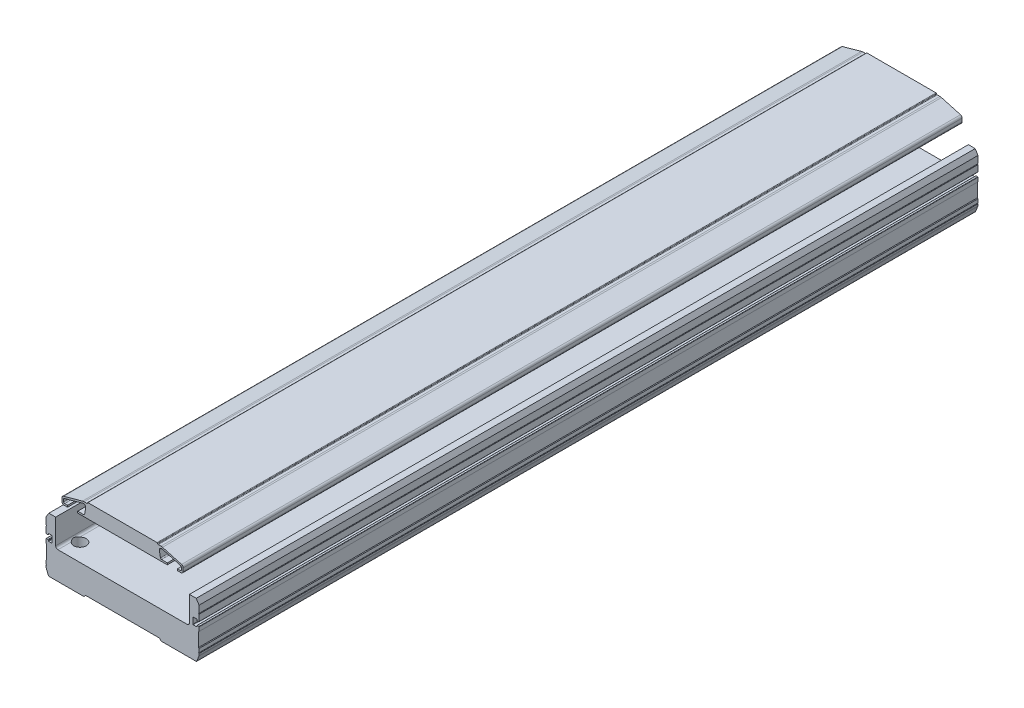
SolidWorks part; units mm, degrees
ref_plane "前视基准面" through (0, 0, 0) normal (0, 0, 1) x (1, 0, 0)
ref_plane "上视基准面" through (0, 0, 0) normal (0, 1, 0) x (1, 0, 0)
ref_plane "右视基准面" through (0, 0, 0) normal (1, 0, 0) x (0, 0, -1)
sketch "草图1" plane through (0, 0, 0) normal (0, 0, 1) x (1, 0, 0)
  line B0 (-39.5, 59.4) -> (39.5, 59.4)
  line B1 (39.5, 59.4) -> (39.5, 60.9)
  line B2 (39.5, 60.9) -> (34.4, 60.9)
  line B3 (33.4138, 61.7343) -> (32.5361, 66.9593)
  line B4 (35.0485, 69.2164) -> (51.27, 64.6675)
  line B5 (52, 63.7046) -> (52, 61.9)
  line B6 (51, 60.9) -> (48.5, 60.9)
  line B7 (48.5, 60.9) -> (48.5, 59.4)
  line B8 (48.5, 59.4) -> (51.5, 59.4)
  line B9 (53.5, 61.4) -> (53.5, 64.0837)
  line B10 (52.04, 66.0094) -> (35.2622, 70.7143)
  line B11 (33.9122, 70.9) -> (31.5, 70.9)
  line B12 (30.5, 71.9) -> (-30.5, 71.9)
  line B13 (-31.5, 70.9) -> (-33.9122, 70.9)
  line B14 (-35.2622, 70.7143) -> (-52.04, 66.0094)
  line B15 (-53.5, 64.0837) -> (-53.5, 61.4)
  line B16 (-51.5, 59.4) -> (-48.5, 59.4)
  line B17 (-48.5, 59.4) -> (-48.5, 60.9)
  line B18 (-48.5, 60.9) -> (-51, 60.9)
  line B19 (-52, 61.9) -> (-52, 63.7046)
  line B20 (-51.27, 64.6675) -> (-35.0485, 69.2164)
  line B21 (-32.5361, 66.9593) -> (-33.4138, 61.7343)
  line B22 (-34.4, 60.9) -> (-39.5, 60.9)
  line B23 (-39.5, 60.9) -> (-39.5, 59.4)
  line B24 (-67, 22) -> (-67, 10)
  line B25 (-67, 10) -> (-67.5, 9.5)
  line B26 (-67.5, 9.5) -> (-67.5, 6.375)
  line B27 (-67.5, 5.625) -> (-67.5, 4.3812)
  line B28 (-67.36, 3.6469) -> (-65.5064, -1.0289)
  line B29 (-65.16, -1.6) -> (-34.1, -1.6)
  line B30 (-34.1, -1.6) -> (-32.5, 0)
  line B31 (-32.5, 0) -> (32.5, 0)
  line B32 (32.5, 0) -> (34.1, -1.6)
  line B33 (34.1, -1.6) -> (65.16, -1.6)
  line B34 (65.5064, -1.0289) -> (67.36, 3.6469)
  line B35 (67.5, 4.3812) -> (67.5, 5.625)
  line B36 (67.5, 6.375) -> (67.5, 9.5)
  line B37 (67.5, 9.5) -> (67, 10)
  line B38 (67, 10) -> (67, 22)
  line B39 (67, 22) -> (67.5, 22.5)
  line B40 (67.5, 22.5) -> (67.5, 25.9)
  line B41 (67.2, 26.2) -> (65.8, 26.2)
  line B42 (65.5, 25.9) -> (65.5, 25.3)
  line B43 (65.2, 25) -> (62.3, 25)
  line B44 (62, 25.3) -> (62, 30.7)
  line B45 (62.3, 31) -> (65.2, 31)
  line B46 (65.5, 30.7) -> (65.5, 30.1)
  line B47 (65.8, 29.8) -> (67.2, 29.8)
  line B48 (67.5, 30.1) -> (67.5, 35.625)
  line B49 (67.5, 36.375) -> (67.5, 42.6)
  line B50 (67.5, 42.6) -> (65, 46.6)
  line B51 (65, 46.6) -> (59, 46.6)
  line B52 (59, 46.6) -> (59, 24.7)
  line B53 (57, 22.7) -> (-57, 22.7)
  line B54 (-59, 24.7) -> (-59, 46.6)
  line B55 (-59, 46.6) -> (-65, 46.6)
  line B56 (-65, 46.6) -> (-67.5, 42.6)
  line B57 (-67.5, 42.6) -> (-67.5, 36.375)
  line B58 (-67.5, 35.625) -> (-67.5, 30.1)
  line B59 (-67.2, 29.8) -> (-65.8, 29.8)
  line B60 (-65.5, 30.1) -> (-65.5, 30.7)
  line B61 (-65.2, 31) -> (-62.3, 31)
  line B62 (-62, 30.7) -> (-62, 25.3)
  line B63 (-62.3, 25) -> (-65.2, 25)
  line B64 (-65.5, 25.3) -> (-65.5, 25.9)
  line B65 (-65.8, 26.2) -> (-67.2, 26.2)
  line B66 (-67.5, 25.9) -> (-67.5, 22.5)
  line B67 (-67.5, 22.5) -> (-67, 22)
  arc B68 (33.4138, 61.7343) -> (34.4, 60.9) centre (34.4, 61.9) ccw
  arc B69 (35.0485, 69.2164) -> (32.5361, 66.9593) centre (34.5085, 67.2906) ccw
  arc B70 (52, 63.7046) -> (51.27, 64.6675) centre (51, 63.7046) ccw
  arc B71 (51, 60.9) -> (52, 61.9) centre (51, 61.9) ccw
  arc B72 (51.5, 59.4) -> (53.5, 61.4) centre (51.5, 61.4) ccw
  arc B73 (53.5, 64.0837) -> (52.04, 66.0094) centre (51.5, 64.0837) ccw
  arc B74 (35.2622, 70.7143) -> (33.9122, 70.9) centre (33.9122, 65.9) ccw
  arc B75 (31, 71.4) -> (31.5, 70.9) centre (31.5, 71.4) ccw
  arc B76 (31, 71.4) -> (30.5, 71.9) centre (30.5, 71.4) ccw
  arc B77 (-30.5, 71.9) -> (-31, 71.4) centre (-30.5, 71.4) ccw
  arc B78 (-31.5, 70.9) -> (-31, 71.4) centre (-31.5, 71.4) ccw
  arc B79 (-33.9122, 70.9) -> (-35.2622, 70.7143) centre (-33.9122, 65.9) ccw
  arc B80 (-52.04, 66.0094) -> (-53.5, 64.0837) centre (-51.5, 64.0837) ccw
  arc B81 (-53.5, 61.4) -> (-51.5, 59.4) centre (-51.5, 61.4) ccw
  arc B82 (-52, 61.9) -> (-51, 60.9) centre (-51, 61.9) ccw
  arc B83 (-51.27, 64.6675) -> (-52, 63.7046) centre (-51, 63.7046) ccw
  arc B84 (-32.5361, 66.9593) -> (-35.0485, 69.2164) centre (-34.5085, 67.2906) ccw
  arc B85 (-34.4, 60.9) -> (-33.4138, 61.7343) centre (-34.4, 61.9) ccw
  arc B86 (-67.5, 5.625) -> (-67.5, 6.375) centre (-67.5, 6) ccw
  arc B87 (-67.5, 4.3812) -> (-67.36, 3.6469) centre (-65.5, 4.382) ccw
  arc B88 (-65.5064, -1.0289) -> (-65.16, -1.6) centre (-63.6472, -0.2918) ccw
  arc B89 (65.16, -1.6) -> (65.5064, -1.0289) centre (63.6472, -0.2918) ccw
  arc B90 (67.36, 3.6469) -> (67.5, 4.3812) centre (65.5, 4.382) ccw
  arc B91 (67.5, 6.375) -> (67.5, 5.625) centre (67.5, 6) ccw
  arc B92 (67.5, 25.9) -> (67.2, 26.2) centre (67.2, 25.9) ccw
  arc B93 (65.8, 26.2) -> (65.5, 25.9) centre (65.8, 25.9) ccw
  arc B94 (65.2, 25) -> (65.5, 25.3) centre (65.2, 25.3) ccw
  arc B95 (62, 25.3) -> (62.3, 25) centre (62.3, 25.3) ccw
  arc B96 (62.3, 31) -> (62, 30.7) centre (62.3, 30.7) ccw
  arc B97 (65.5, 30.7) -> (65.2, 31) centre (65.2, 30.7) ccw
  arc B98 (65.5, 30.1) -> (65.8, 29.8) centre (65.8, 30.1) ccw
  arc B99 (67.2, 29.8) -> (67.5, 30.1) centre (67.2, 30.1) ccw
  arc B100 (67.5, 36.375) -> (67.5, 35.625) centre (67.5, 36) ccw
  arc B101 (57, 22.7) -> (59, 24.7) centre (57, 24.7) ccw
  arc B102 (-59, 24.7) -> (-57, 22.7) centre (-57, 24.7) ccw
  arc B103 (-67.5, 35.625) -> (-67.5, 36.375) centre (-67.5, 36) ccw
  arc B104 (-67.5, 30.1) -> (-67.2, 29.8) centre (-67.2, 30.1) ccw
  arc B105 (-65.8, 29.8) -> (-65.5, 30.1) centre (-65.8, 30.1) ccw
  arc B106 (-65.2, 31) -> (-65.5, 30.7) centre (-65.2, 30.7) ccw
  arc B107 (-62, 30.7) -> (-62.3, 31) centre (-62.3, 30.7) ccw
  arc B108 (-62.3, 25) -> (-62, 25.3) centre (-62.3, 25.3) ccw
  arc B109 (-65.5, 25.3) -> (-65.2, 25) centre (-65.2, 25.3) ccw
  arc B110 (-65.5, 25.9) -> (-65.8, 26.2) centre (-65.8, 25.9) ccw
  arc B111 (-67.2, 26.2) -> (-67.5, 25.9) centre (-67.2, 25.9) ccw
sketch_block_instance "块4-1"
sketch_block "块4"
extrude "凸台-拉伸1" add sketch "草图1" against normal blind 687
hole_wizard "打孔尺寸(%根据)内六角圆柱头螺钉的类型1" positions "草图3" profile "草图4" counterbore size "M6" standard "GB"
sketch "草图3" plane through (0, 46.6, 0) normal (0, 1, 0) x (1, 0, 0)
  line L4 (34.1, 687) -> (65.16, 687) construction
  line L5 (0, 687) -> (0, 1140.2602) construction
  line L6 (-32.5, 687) -> (32.5, 687) construction
  point P0 (-53, 615.5)
  point P2 (53, 615.5)
  point P13 (53, 415.5)
  point P15 (-53, 415.5)
  point P22 (53, 215.5)
  point P24 (-53, 215.5)
  point P25 (53, 15.5)
  point P27 (-53, 15.5)
  point P29 (53, -184.5)
  point P31 (-53, -184.5)
  point P33 (53, -384.5)
  point P35 (-53, -384.5)
  point P45 (-53, -584.5)
  point P47 (53, -584.5)
  dimension "D1" = 106
  dimension "D2" = 200
  dimension "D3" = 71.5
  dimension "D4" = 200
  dimension "D5" = 200
  dimension "D6" = 200
  dimension "D7" = 200
  dimension "D8" = 200
sketch "草图4" plane through (-53, 46.6, -615.5) normal (1, 0, 0) x (0, 0, 1)
  line L0 (0, 0) -> (0, 48.2)
  line L1 (0, 48.2) -> (3.5, 48.2)
  line L3 (3.5, 48.2) -> (3.5, 41)
  line L4 (3.5, 41) -> (5.5, 41)
  line L5 (5.5, 41) -> (5.5, 0)
  line L7 (5.5, 0) -> (0, 0)
  line L11 (0, -6.35) -> (0, 107.95) construction
  dimension "通孔孔直径" = 7
  dimension "通孔孔深度" = 48.2
  dimension "柱形沉头孔直径" = 11
  dimension "柱形沉头孔深度" = 41
hole_wizard "M6 螺纹孔0" positions "草图5" profile "草图6" tap size "M6" standard "GB"
sketch "草图5" plane through (0, -1.6, 0) normal (0, -1, 0) x (-1, 0, 0)
  line L0 (53, 615.5) -> (53, 625.5) construction
  line L1 (-53, 615.5) -> (-53, 625.5) construction
  line L4 (65.16, 687) -> (34.1, 687) construction
  point P0 (53, 625.5)
  point P2 (-53, 625.5)
  point P12 (53, 425.5)
  point P14 (-53, 425.5)
  point P19 (-53, 225.5)
  point P21 (53, 225.5)
  point P23 (-53, 25.5)
  point P25 (53, 25.5)
  point P27 (-53, -174.5)
  point P29 (53, -174.5)
  point P31 (-53, -374.5)
  point P33 (53, -374.5)
  point P36 (53, -574.5)
  point P38 (-53, -574.5)
  dimension "D1" = 61.5
  dimension "D2" = 200
  dimension "D3" = 200
  dimension "D4" = 200
  dimension "D5" = 200
  dimension "D6" = 200
  dimension "D7" = 200
sketch "草图6" plane through (-53, -1.6, -625.5) normal (1, 0, 0) x (0, 0, -1)
  line L0 (0, 0) -> (0, 16.5022)
  line L1 (0, 16.5022) -> (2.5, 15)
  line L2 (2.5, 15) -> (2.5, 0)
  line L5 (2.5, 0) -> (0, 0)
  line L10 (0, 16.5022) -> (-2.5, 15) construction
  line L11 (0, -6.35) -> (0, 107.95) construction
  dimension "螺纹孔钻头直径" = 5
  dimension "螺纹孔钻头深度" = 15
  dimension "导头角度" = 118
